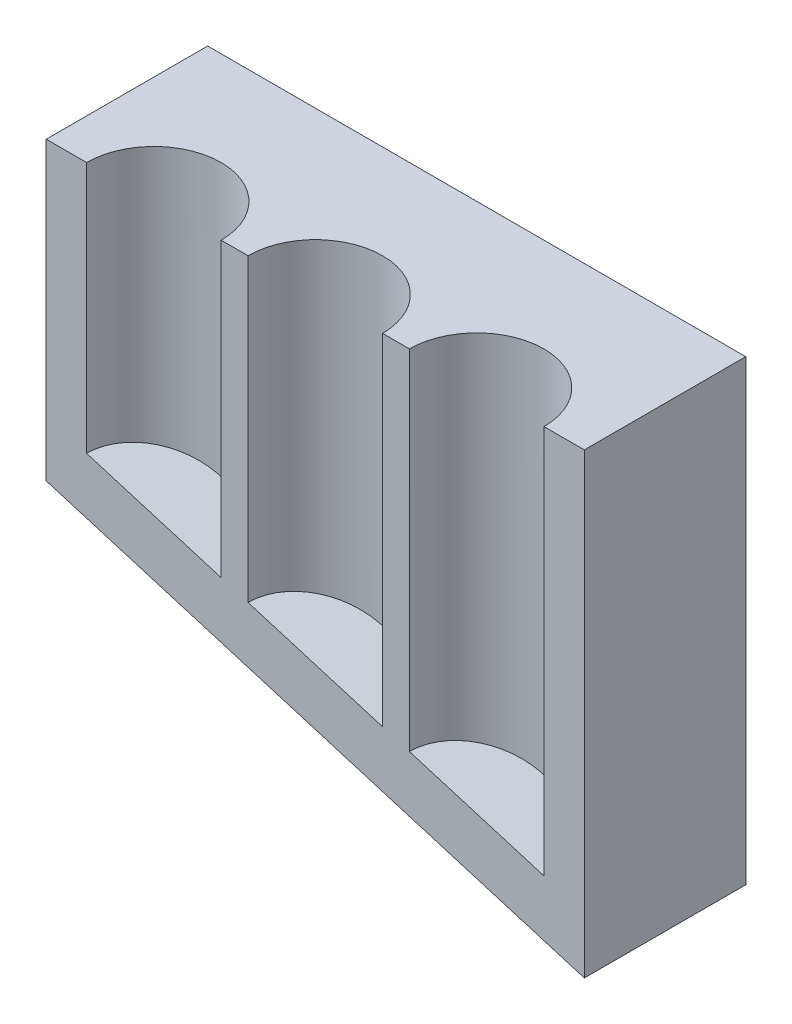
SolidWorks part; units mm, degrees
ref_plane "Front Plane" through (0, 0, 0) normal (0, 0, 1) x (1, 0, 0)
ref_plane "Top Plane" through (0, 0, 0) normal (0, 1, 0) x (1, 0, 0)
ref_plane "Right Plane" through (0, 0, 0) normal (1, 0, 0) x (0, 0, -1)
sketch "Sketch1" plane through (0, 0, 0) normal (0, 0, 1) x (1, 0, 0)
  line L1 (0, 0) -> (100, -30)
  line L2 (0, 0) -> (0, 55)
  line L3 (0, 55) -> (100, 55)
  line L4 (100, -30) -> (100, 55)
  dimension "D1" = 100
  dimension "D2" = 85
  dimension "D3" = 55
extrude "Extrude1" add sketch "Sketch1" along normal blind 30
sketch "Sketch2" plane through (0, 55, 0) normal (0, 1, 0) x (1, 0, 0)
  line L0 (100, -30) -> (0, -30) construction
  line L1 (0, -30) -> (0, 0) construction
  circle A0 centre (20, -30) radius 12.5
  dimension "D1" = 25
  dimension "D2" = 20
extrude "Extrude2" cut sketch "Sketch2" against normal offset from surface (68.5597 mm away) 10
pattern_linear "LPattern1" count 3 spacing 30 along (0.9578, -0.2873, 0) of "Extrude2"
